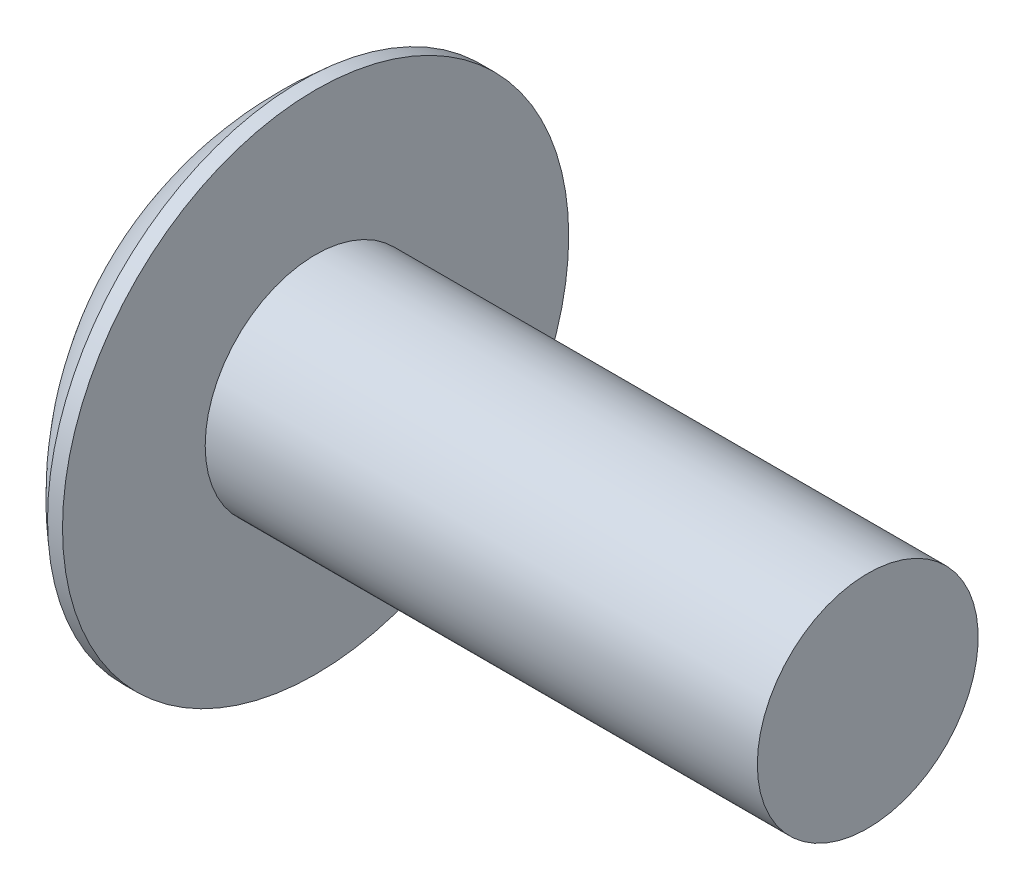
SolidWorks part; units mm, degrees
ref_plane "Plane1" through (0, 0, 0) normal (0, 0, 1) x (1, 0, 0)
ref_plane "Plane2" through (0, 0, 0) normal (0, 1, 0) x (1, 0, 0)
ref_plane "Plane3" through (0, 0, 0) normal (1, 0, 0) x (0, 0, -1)
sketch "BodySke" plane through (0, 0, 0) normal (0, 0, 1) x (1, 0, 0)
  line L0 (3.81, 3.175) -> (3.81, 7.2771)
  line L1 (19.685, 0) -> (0, 0)
  line L2 (-25.4, 0) -> (127, 0) construction
  line L3 (3.3793, -7.2771) -> (3.81, -7.2771) construction
  line L4 (3.81, 3.175) -> (19.685, 3.175)
  line L5 (19.685, 3.175) -> (19.685, 0)
  line L6 (3.3793, 7.2771) -> (3.81, 7.2771)
  line L7 (3.81, -3.175) -> (19.685, -3.175) construction
  line L8 (5.08, 4.7625) -> (5.08, -4.7625) construction
  line L9 (3.81, 6.35) -> (3.81, -3.175) construction
  arc A0 (3.3793, 7.2771) -> (0, 0) centre (9.525, 0) ccw
  dimension "Head_rad" = 9.525
  dimension "Head_ht" = 3.81
  dimension "Diameter" = 6.35
  dimension "Length" = 15.875
  dimension "Head_dia" = 14.5542
  dimension "Advance" = 1.27
  dimension "Thread_nom" = 15.875
revolve "Base-Revolve" add sketch "BodySke" angle 360 about L2
sketch "Sketch2" plane through (0, 0, 0) normal (1, 0, 0) x (0, 0, -1)
  line L0 (7.2771, -0.9525) -> (-7.2771, -0.9525)
  line L1 (7.2771, -0.9525) -> (7.2771, 0.9525)
  line L2 (-7.2771, 0.9525) -> (7.2771, 0.9525)
  line L3 (-7.2771, 0.9525) -> (-7.2771, -0.9525)
  dimension "D1" = 14.5542
  dimension "D2" = 7.2771
  dimension "Slot_width" = 1.905
  dimension "D3" = 0.9525
extrude "Slot" [suppressed] cut sketch "Sketch2" along normal blind 2.2098
sketch "Sketch3" plane through (0, 0, 0) normal (1, 0, 0) x (0, 0, -1)
  line L0 (0.7239, -4.0767) -> (-0.7239, -4.0767)
  line L1 (0.7239, -4.0767) -> (0.7239, 4.0767)
  line L2 (-0.7239, 4.0767) -> (0.7239, 4.0767)
  line L3 (-0.7239, 4.0767) -> (-0.7239, -4.0767)
  dimension "D1" = 0.7239
  dimension "Cross_width" = 1.4478
  dimension "Cross_dia" = 8.1534
  dimension "D2" = 4.0767
ref_plane "Plane4" through (4.6228, 0, 0) normal (1, 0, 0) x (0, 0, -1)
sketch "Sketch4" plane through (4.6228, 0, 0) normal (1, 0, 0) x (0, 0, -1)
  line L0 (0.3619, -0.3619) -> (-0.3619, -0.362)
  line L1 (0.3619, -0.3619) -> (0.3619, 0.3619)
  line L2 (-0.3619, 0.3619) -> (0.3619, 0.3619)
  line L3 (-0.3619, 0.3619) -> (-0.3619, -0.362)
  dimension "D1" = 0.7239
  dimension "D2" = 0.3619
  dimension "D3" = 0.7239
  dimension "D4" = 0.3619
loft "Cross" cut profiles "Sketch3", "Sketch4"
pattern_circular "CirPattern1" count 2 every 90 about axis through (0, 0, 0) along (1, 0, 0) of "Cross"
sketch "ThdSchSke" plane through (0, 0, 0) normal (0, 0, 1) x (1, 0, 0)
  line L0 (5.08, -2.4193) -> (4.5509, -3.175)
  line L1 (5.08, -2.4193) -> (5.6091, -3.175)
  line L2 (5.6091, -3.175) -> (5.6091, -3.9688)
  line L3 (-3.175, 0) -> (5.1513, 0) construction
  line L5 (5.6091, -3.9688) -> (4.5509, -3.9688)
  line L6 (4.5509, -3.9688) -> (4.5509, -3.175)
  dimension "Thread_minor" = 4.8387
  dimension "Diameter" = 6.35
  dimension "Start" = 5.08
  dimension "SideAngle" = 55
  dimension "VeeAngle" = 70
  dimension "Overcut" = 7.9375
revolve "ThreadSchematic" [suppressed] cut sketch "ThdSchSke" angle 360 about L3
pattern_linear "ThdSchPat" [suppressed]
equation "\"D1@Sketch2\" = \"Head_dia@BodySke\""
equation "\"D2@Sketch2\" = \"D1@Sketch2\" / 2"
equation "\"D3@Sketch2\" = \"Slot_width@Sketch2\" / 2"
equation "\"D1@Sketch3\" = \"Cross_width@Sketch3\" / 2"
equation "\"D2@Sketch3\" = \"Cross_dia@Sketch3\" / 2"
equation "\"D1@Sketch4\" = \"Cross_width@Sketch3\" *.5"
equation "\"D2@Sketch4\" = \"D1@Sketch4\" / 2"
equation "\"D3@Sketch4\" = \"D1@Sketch4\""
equation "\"D4@Sketch4\" = \"D3@Sketch4\" / 2"
equation "\"Thread_length@ThreadCosmetic\" = ((sgn( (\"Length@BodySke\" - \"Advance@BodySke\" ) - \"Thread_nom@BodySke\" )-1)*( (\"Length@BodySke\" - \"Advance@BodySke\" ) - \"Thread_nom@BodySke\" ))/-2+ \"Thread_nom@BodySke\""
equation "\"Thread_minor@ThdSchSke\" = \"Thread_minor@ThreadCosmetic\""
equation "\"Diameter@ThdSchSke\" = \"Diameter@BodySke\""
equation "\"Overcut@ThdSchSke\" = \"Diameter@BodySke\" * 1.25"
equation "\"Start@ThdSchSke\" = \"Head_ht@BodySke\" + \"Length@BodySke\" - \"Thread_length@ThreadCosmetic\"  '---Non-countersunk---"
equation "\"Num_threads@ThdSchPat\" = int( \"Thread_length@ThreadCosmetic\" / \"Advance@BodySke\" + 0.999 )  + 1"
equation "\"Advance@ThdSchPat\" = \"Thread_length@ThreadCosmetic\" /  (\"Num_threads@ThdSchPat\" - 1) 'relax it"
